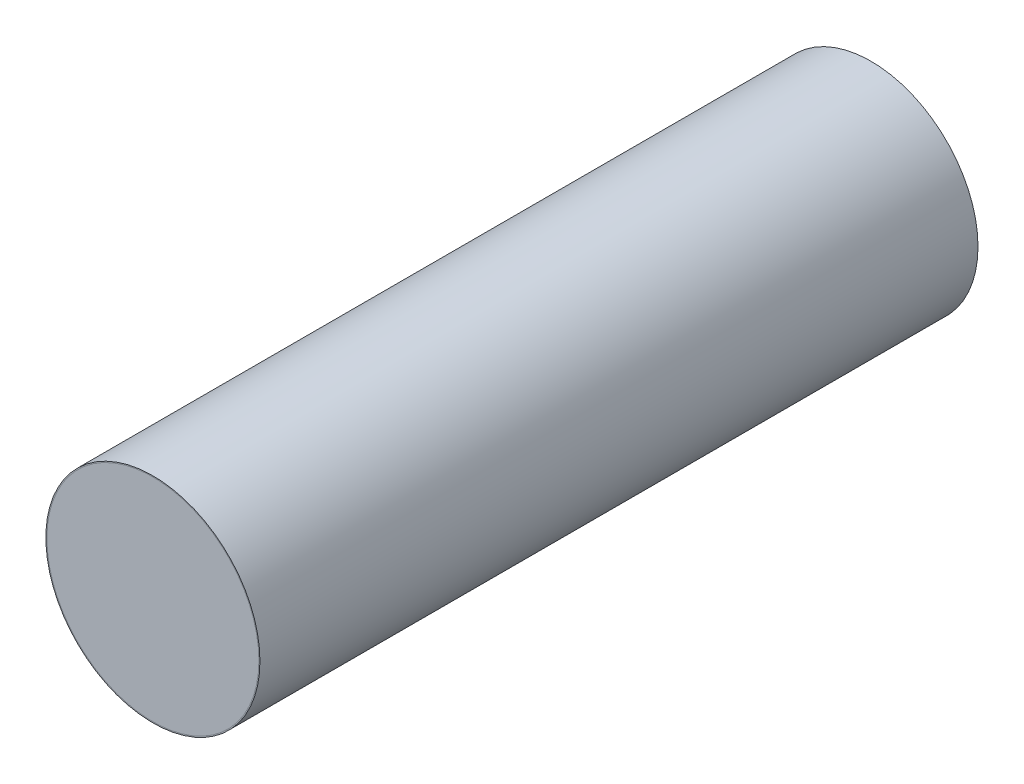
SolidWorks part; units mm, degrees
other "GAP_Intereference"
other "CORE_JellyRoll"
other "END_Top"
other "END_Bottom"
other "Wrap_Sleeve"
other "CAP_Top"
other "CAN_STEEL"
ref_plane "Front Plane" through (0, 0, 0) normal (0, 0, 1) x (1, 0, 0)
ref_plane "Top Plane" through (0, 0, 0) normal (0, 1, 0) x (1, 0, 0)
ref_plane "Right Plane" through (0, 0, 0) normal (1, 0, 0) x (0, 0, -1)
sketch "Sketch1" plane through (0, 0, 0) normal (0, 0, 1) x (1, 0, 0)
  circle A0 centre (0, 0) radius 10.35
  dimension "D1" = 20.7
extrude "Boss-Extrude1" add sketch "Sketch1" along normal blind 0.3
sketch "Sketch2" plane through (0, 0, 0) normal (0, 0, 1) x (1, 0, 0)
  circle A0 centre (0, 0) radius 10.35
  circle A1 centre (0, 0) radius 10.13
  dimension "D1" = 20.7
  dimension "D2" = 20.26
extrude "Boss-Extrude2" add sketch "Sketch2" along normal blind 69 from offset 0.3
sketch "Sketch3" plane through (0, 0, 0) normal (0, 0, 1) x (1, 0, 0)
  circle A0 centre (0, 0) radius 10.35
  dimension "D1" = 20.7
extrude "Boss-Extrude4" add sketch "Sketch3" along normal blind 0.8 from offset 69.3 separate body
sketch "Sketch4" plane through (0, 0, 0) normal (0, 0, 1) x (1, 0, 0)
  circle A0 centre (0, 0) radius 10.45
  circle A1 centre (0, 0) radius 10.35
  dimension "D1" = 20.9
  dimension "D2" = 20.7
extrude "Boss-Extrude5" add sketch "Sketch4" along normal blind 70.1 separate body
sketch "Sketch5" plane through (0, 0, 0) normal (0, 0, 1) x (1, 0, 0)
  circle A0 centre (0, 0) radius 10.13
  dimension "D1" = 20.26
extrude "Boss-Extrude7" add sketch "Sketch5" along normal blind 2.2 from offset 0.3 separate body
sketch "Sketch6" plane through (0, 0, 0) normal (0, 0, 1) x (1, 0, 0)
  circle A0 centre (0, 0) radius 10.13
  dimension "D1" = 20.26
extrude "Boss-Extrude8" add sketch "Sketch6" along normal blind 1.8 from offset 67.5 separate body
sketch "Sketch7" plane through (0, 0, 0) normal (0, 0, 1) x (1, 0, 0)
  circle A0 centre (0, 0) radius 10.03
  circle A1 centre (0, 0) radius 1.5
  dimension "D1" = 20.06
  dimension "D2" = 3
extrude "Boss-Extrude9" add sketch "Sketch7" along normal blind 65 from offset 2.5 separate body
sketch "Sketch8" plane through (0, 0, 0) normal (0, 0, 1) x (1, 0, 0)
  circle A0 centre (0, 0) radius 10.13
  circle A1 centre (0, 0) radius 10.03
  dimension "D1" = 20.26
  dimension "D2" = 20.06
extrude "Boss-Extrude10" add sketch "Sketch8" along normal blind 65 from offset 2.5 separate body
